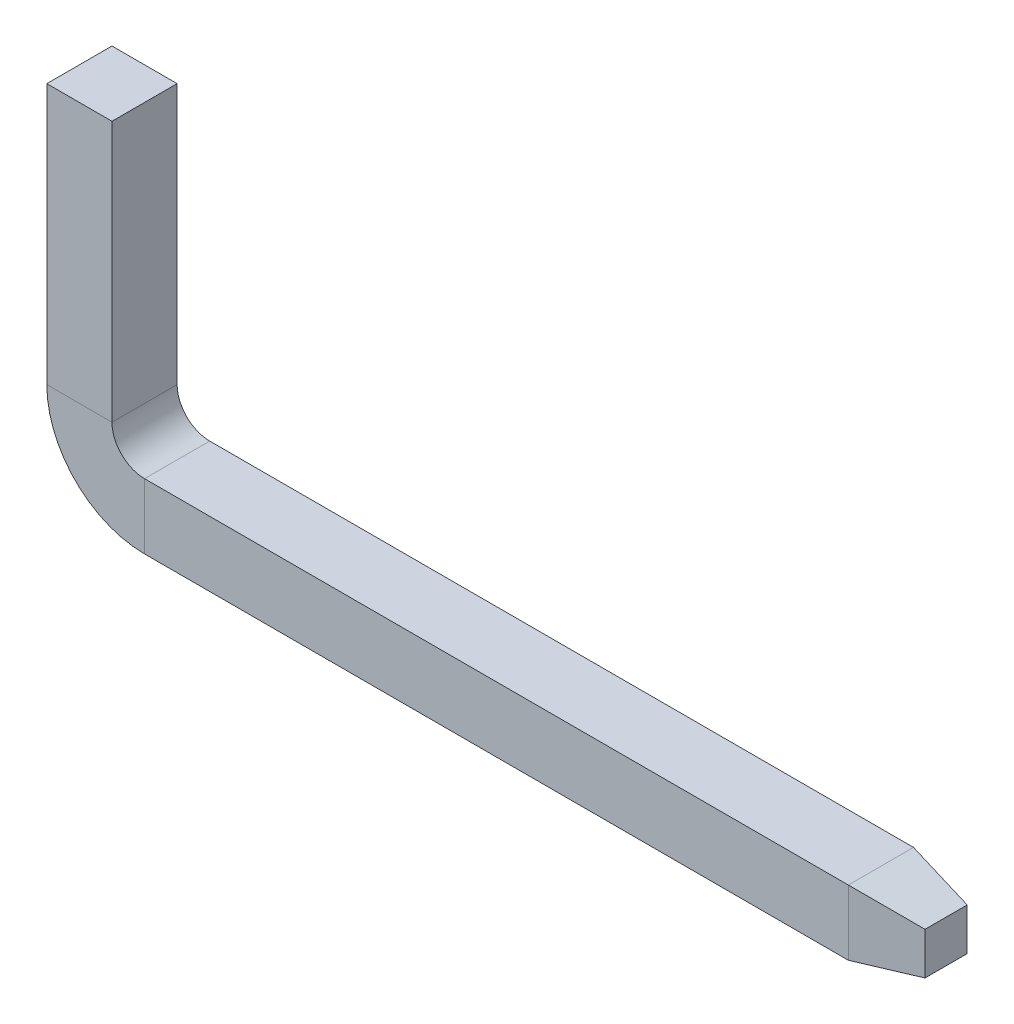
SolidWorks part; units mm, degrees
ref_plane "Front Plane" through (0, 0, 0) normal (0, 0, 1) x (1, 0, 0)
ref_plane "Top Plane" through (0, 0, 0) normal (0, 1, 0) x (1, 0, 0)
ref_plane "Right Plane" through (0, 0, 0) normal (1, 0, 0) x (0, 0, -1)
sketch "Sketch1" plane through (0, 0, 0) normal (0, 1, 0) x (1, 0, 0)
  line L1 (-0.25, -0.25) -> (0.25, -0.25)
  line L2 (-0.25, -0.25) -> (-0.25, 0.25)
  line L3 (-0.25, 0.25) -> (0.25, 0.25)
  line L4 (0.25, -0.25) -> (0.25, 0.25)
  line L5 (-0.25, -0.25) -> (0.25, 0.25) construction
  line L6 (-0.25, 0.25) -> (0.25, -0.25) construction
  point P0 (0, 0)
  dimension "D1" = 0.5
sketch "Sketch2" plane through (0, 0, 0) normal (0, 0, 1) x (1, 0, 0)
  line L0 (0, 0) -> (0, -2)
  line L1 (0.5, -2.5) -> (5.9, -2.5)
  arc A0 (0, -2) -> (0.5, -2.5) centre (0.5, -2) ccw
  point P6 (0, -2.5)
  point P7 (0, 0)
  point P8 (0, 0)
  dimension "D3" = 0.5
  dimension "D1" = 2.5
  dimension "D2" = 5.9
ref_plane "Plane1" through (5.9, 0, 0) normal (1, 0, 0) x (0, 0, -1)
sweep "Sweep1" add profiles "Sketch1" path "Sketch2"
sketch "Sketch4" plane through (5.9, 0, 0) normal (1, 0, 0) x (0, 0, -1)
  line L4 (0.25, -2.25) -> (-0.25, -2.25)
  line L5 (-0.25, -2.25) -> (-0.25, -2.75)
  line L6 (-0.25, -2.75) -> (0.25, -2.75)
  line L7 (0.25, -2.75) -> (0.25, -2.25)
  line L8 (0.25, -2.25) -> (-0.25, -2.25)
  line L9 (-0.25, -2.25) -> (-0.25, -2.75)
  line L10 (-0.25, -2.75) -> (0.25, -2.75)
  line L11 (0.25, -2.75) -> (0.25, -2.25)
  dimension "D1" = 0
extrude "Boss-Extrude1" add sketch "Sketch4" along normal blind 0.5 draft 10
